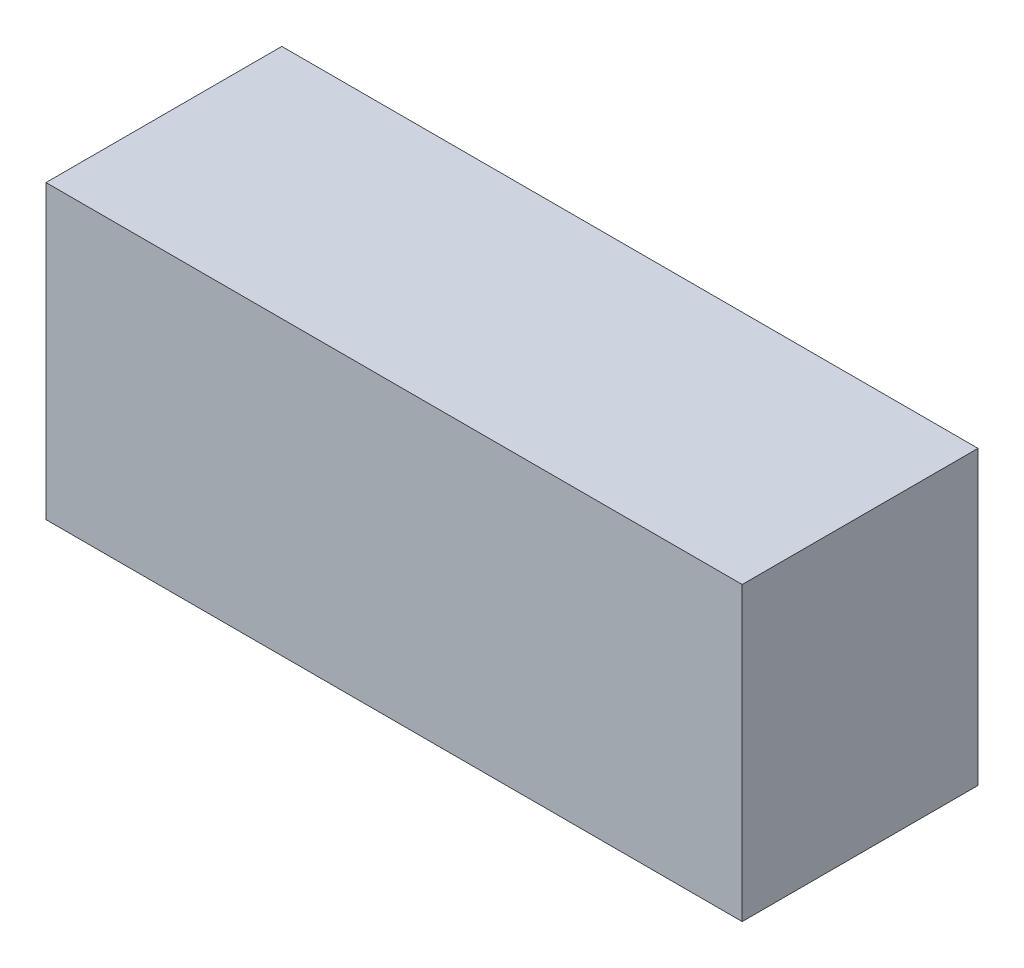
SolidWorks part; units mm, degrees
ref_plane "Front Plane" through (0, 0, 0) normal (0, 0, 1) x (1, 0, 0)
ref_plane "Top Plane" through (0, 0, 0) normal (0, 1, 0) x (1, 0, 0)
ref_plane "Right Plane" through (0, 0, 0) normal (1, 0, 0) x (0, 0, -1)
sketch "Component_Outline" plane through (0, 0, 0) normal (0, 0, 1) x (1, 0, 0)
  line L0 (-4, -1.9) -> (-4, 1.402)
  line L1 (-4, 1.402) -> (3.874, 1.402)
  line L2 (3.874, 1.402) -> (3.874, -1.9)
  line L3 (3.874, -1.9) -> (-4, -1.9)
  dimension "D1" = 7.874
  dimension "D2" = 3.302
extrude "Boss-Extrude1" add sketch "Component_Outline" along normal blind 2.667
